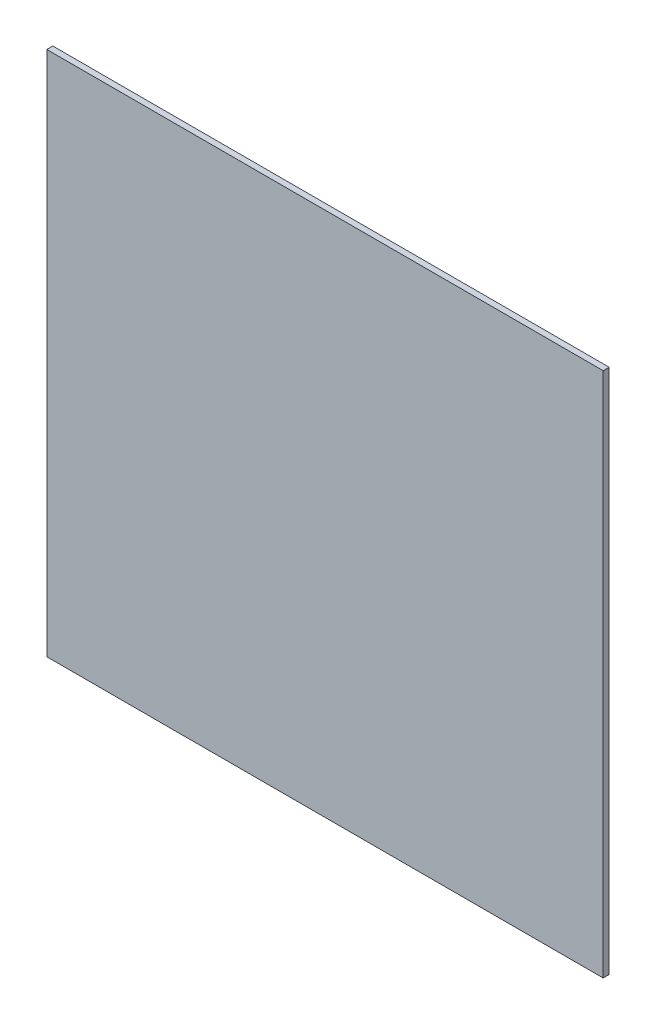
SolidWorks part; units mm, degrees
ref_plane "Plan de face" through (0, 0, 0) normal (0, 0, 1) x (1, 0, 0)
ref_plane "Plan de dessus" through (0, 0, 0) normal (0, 1, 0) x (1, 0, 0)
ref_plane "Plan de droite" through (0, 0, 0) normal (1, 0, 0) x (0, 0, -1)
sketch "Esquisse1" plane through (0, 0, 0) normal (0, 0, 1) x (1, 0, 0)
  line L1 (-1515.5, 1965) -> (-34.5, 1965)
  line L2 (-1515.5, 1965) -> (-1515.5, 565)
  line L3 (-1515.5, 565) -> (-34.5, 565)
  line L4 (-34.5, 1965) -> (-34.5, 565)
  line L5 (-29.5, 0) -> (-29.5, 2000) construction
  line L6 (-9.9196, 2000) -> (-38.2342, 2000) construction
  line L7 (-1520.5, 2000) -> (-1520.5, 0) construction
  dimension "D1" = 5
  dimension "D2" = 5
  dimension "D3" = 35
  dimension "D4" = 1400
extrude "Extrusion1" add sketch "Esquisse1" along normal mid plane 16
